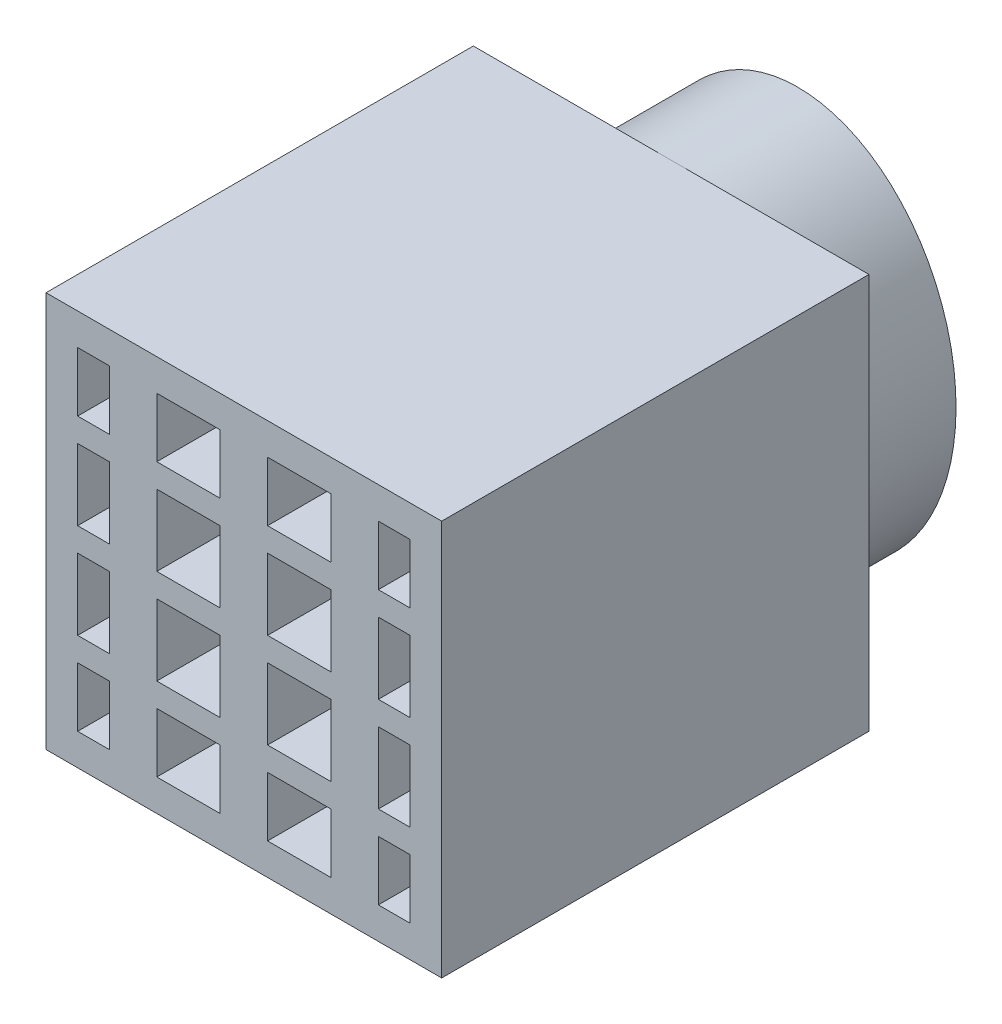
SolidWorks part; units mm, degrees
ref_plane "前视基准面" through (0, 0, 0) normal (0, 0, 1) x (1, 0, 0)
ref_plane "上视基准面" through (0, 0, 0) normal (0, 1, 0) x (1, 0, 0)
ref_plane "右视基准面" through (0, 0, 0) normal (1, 0, 0) x (0, 0, -1)
sketch "草图8" plane through (0, 0, 0) normal (0, 0, 1) x (1, 0, 0)
  line L0 (0, 7.8741) -> (0, -9.2542) construction
  line L1 (-12.5, -12.5) -> (12.5, -12.5)
  line L2 (-12.5, -12.5) -> (-12.5, 12.5)
  line L3 (-12.5, 12.5) -> (12.5, 12.5)
  line L4 (12.5, -12.5) -> (12.5, 12.5)
  line L5 (-12.5, -12.5) -> (12.5, 12.5) construction
  line L6 (-12.5, 12.5) -> (12.5, -12.5) construction
  line L7 (-16.0619, 0) -> (15.5648, 0) construction
  line L8 (-3.5, 7.8741) -> (-3.5, -9.2542) construction
  line L9 (-9.5, 7.8741) -> (-9.5, -9.2542) construction
  line L10 (5.5, 10.5) -> (1.5, 10.5)
  line L15 (-5.5, -10.5) -> (-1.5, -10.5)
  line L20 (-5.5, -10.5) -> (-5.5, 10.5)
  line L21 (-5.5, 10.5) -> (-1.5, 10.5)
  line L26 (-1.5, -10.5) -> (-1.5, 10.5)
  line L27 (-5.5, -10.5) -> (-1.5, 10.5) construction
  line L28 (-5.5, 10.5) -> (-1.5, -10.5) construction
  line L29 (-10.5, -10.5) -> (-8.5, -10.5)
  line L30 (-10.5, -10.5) -> (-10.5, 10.5)
  line L31 (-10.5, 10.5) -> (-8.5, 10.5)
  line L32 (-8.5, -10.5) -> (-8.5, 10.5)
  line L33 (-10.5, -10.5) -> (-8.5, 10.5) construction
  line L34 (-10.5, 10.5) -> (-8.5, -10.5) construction
  line L35 (1.5, -10.5) -> (1.5, 10.5)
  line L36 (5.5, -10.5) -> (1.5, -10.5)
  line L37 (5.5, -10.5) -> (5.5, 10.5)
  line L38 (10.5, 10.5) -> (8.5, 10.5)
  line L39 (8.5, -10.5) -> (8.5, 10.5)
  line L40 (10.5, -10.5) -> (8.5, -10.5)
  line L41 (10.5, -10.5) -> (10.5, 10.5)
  point P0 (0, 0)
  point P14 (-7, 0)
  point P15 (-3.5, 0)
  point P17 (-3, 0)
  point P21 (-9.5, 0)
  point P22 (-9, 0)
  dimension "D1" = 3.5
  dimension "D2" = 6
extrude "凸台-拉伸7" add sketch "草图8" along normal blind 25
sketch "草图9" plane through (0, 0, 0) normal (0, 0, -1) x (-1, 0, 0)
  line L1 (-12.5, -12.5) -> (12.5, -12.5)
  line L2 (-12.5, -12.5) -> (-12.5, 12.5)
  line L3 (-12.5, 12.5) -> (12.5, 12.5)
  line L4 (12.5, -12.5) -> (12.5, 12.5)
  line L5 (-12.5, -12.5) -> (12.5, 12.5) construction
  line L6 (-12.5, 12.5) -> (12.5, -12.5) construction
  point P0 (0, 0)
extrude "凸台-拉伸8" add sketch "草图9" along normal blind 2
sketch "草图14" plane through (0, 0, 25) normal (0, 0, 1) x (1, 0, 0)
  line L0 (-16.6961, 0) -> (20.7273, 0) construction
  line L1 (-12.5, 12.5) -> (-12.5, -12.5) construction
  line L2 (12.5, -0.75) -> (-12.5, -0.75)
  line L3 (12.5, -0.75) -> (12.5, 0.75)
  line L4 (12.5, 0.75) -> (-12.5, 0.75)
  line L5 (-12.5, -0.75) -> (-12.5, 0.75)
  line L6 (12.5, -0.75) -> (-12.5, 0.75) construction
  line L7 (12.5, 0.75) -> (-12.5, -0.75) construction
  line L12 (12.5, 5.25) -> (-12.5, 5.25)
  line L13 (12.5, 5.25) -> (12.5, 6.75)
  line L14 (12.5, 6.75) -> (-12.5, 6.75)
  line L15 (-12.5, 5.25) -> (-12.5, 6.75)
  line L16 (12.5, 5.25) -> (-12.5, 6.75) construction
  line L17 (12.5, 6.75) -> (-12.5, 5.25) construction
  line L18 (12.5, -6.75) -> (-12.5, -5.25) construction
  line L19 (12.5, -5.25) -> (-12.5, -6.75) construction
  line L20 (-12.5, -5.25) -> (-12.5, -6.75)
  line L21 (12.5, -6.75) -> (-12.5, -6.75)
  line L22 (12.5, -5.25) -> (12.5, -6.75)
  line L23 (12.5, -5.25) -> (-12.5, -5.25)
  point P3 (0, 0)
  point P11 (0, 6)
  point P19 (0, -6)
  dimension "D1" = 2
extrude "凸台-拉伸11" add sketch "草图14" against normal blind 25
sketch "草图16" plane through (0, 0, -2) normal (0, 0, -1) x (-1, 0, 0)
  line L1 (-20.8953, 0) -> (21.3992, 0) construction
  line L2 (0, 14.5627) -> (0, -19.3588) construction
  ellipse E0 centre (0, 0) end of major axis (0, -12.5) minor radius 10
  ellipse E1 centre (0, 0) end of major axis (0, -10.5) minor radius 8
extrude "凸台-拉伸14" add sketch "草图16" along normal blind 6
sketch "草图22" plane through (0, 0, -8) normal (0, 0, -1) x (-1, 0, 0)
  ellipse E0 centre (0, 0) end of major axis (0, -12.5) minor radius 10 construction
  ellipse E1 centre (0, 0) end of major axis (0, -12.5) minor radius 10
extrude "凸台-拉伸18" add sketch "草图22" along normal blind 2
